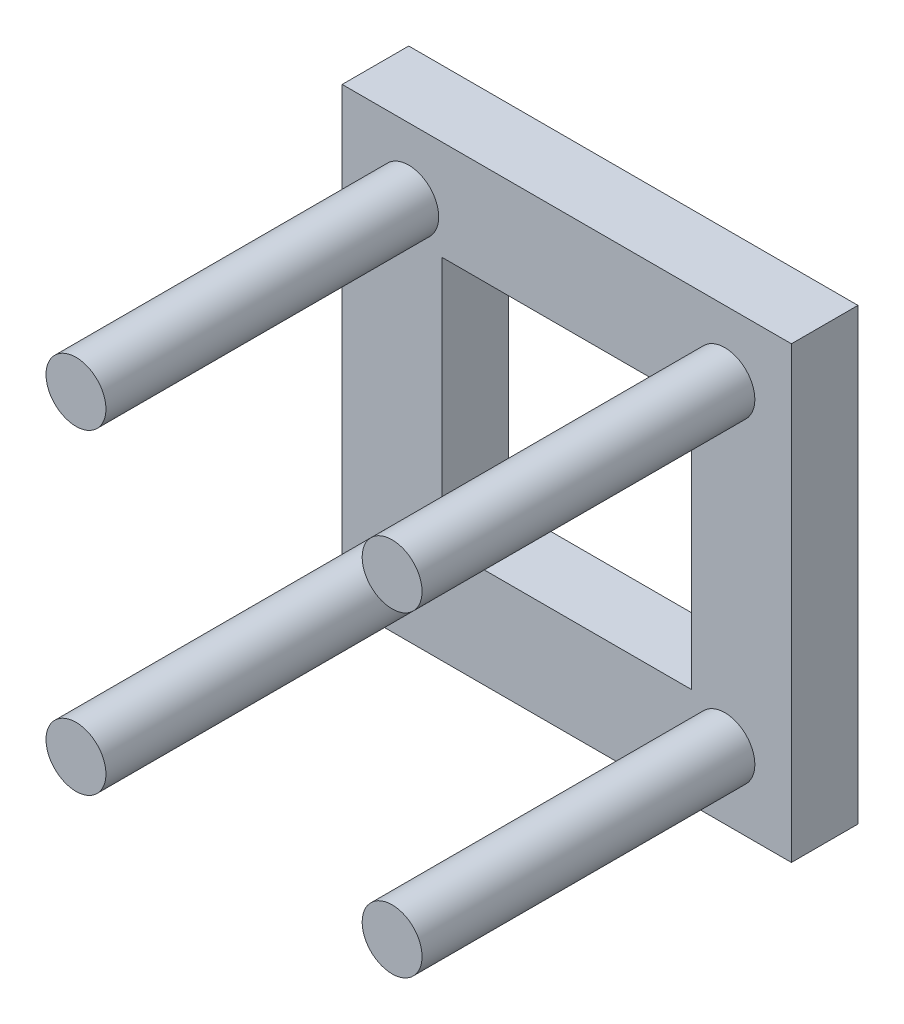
SolidWorks part; units mm, degrees
ref_plane "Plan de face" through (0, 0, 0) normal (0, 0, 1) x (1, 0, 0)
ref_plane "Plan de dessus" through (0, 0, 0) normal (0, 1, 0) x (1, 0, 0)
ref_plane "Plan de droite" through (0, 0, 0) normal (1, 0, 0) x (0, 0, -1)
ref_plane "Plan1" through (0, 0, -1) normal (0, 0, 1) x (1, 0, 0)
sketch "Esquisse2" plane through (0, 0, -1) normal (0, 0, 1) x (1, 0, 0)
  line L0 (37.5, 36.5) -> (37.5, -36.5) construction
  line L1 (36.5, 37.5) -> (-36.5, 37.5) construction
  line L2 (36.5, -37.5) -> (-36.5, -37.5) construction
  line L3 (-37.5, -36.5) -> (-37.5, 36.5) construction
  line L4 (37.5, 37.5) -> (37.5, -37.5)
  line L5 (37.5, 37.5) -> (-37.5, 37.5)
  line L6 (37.5, -37.5) -> (-37.5, -37.5)
  line L7 (-37.5, -37.5) -> (-37.5, 37.5)
  line L11 (67.5, 67.5) -> (67.5, -67.5)
  line L12 (67.5, -67.5) -> (-67.5, -67.5)
  line L13 (-67.5, -67.5) -> (-67.5, 67.5)
  line L14 (67.5, 67.5) -> (-67.5, 67.5)
  dimension "D1" = 30
extrude "Boss.-Extru.1" add sketch "Esquisse2" against normal up to surface (20 mm away)
sketch "Esquisse3" plane through (0, 0, -1) normal (0, 0, 1) x (1, 0, 0)
  line L0 (-67.5, 67.5) -> (67.5, -67.5) construction
  line L1 (67.5, 67.5) -> (-67.5, -67.5) construction
  circle A0 centre (-47.5, 47.5) radius 9
  circle A1 centre (47.5, 47.5) radius 9
  circle A2 centre (-47.5, -47.5) radius 9
  circle A3 centre (47.5, -47.5) radius 9
  dimension "D1" = 18
  dimension "D2" = 95
  dimension "D3" = 95
extrude "Boss.-Extru.2" add sketch "Esquisse3" along normal blind 100
